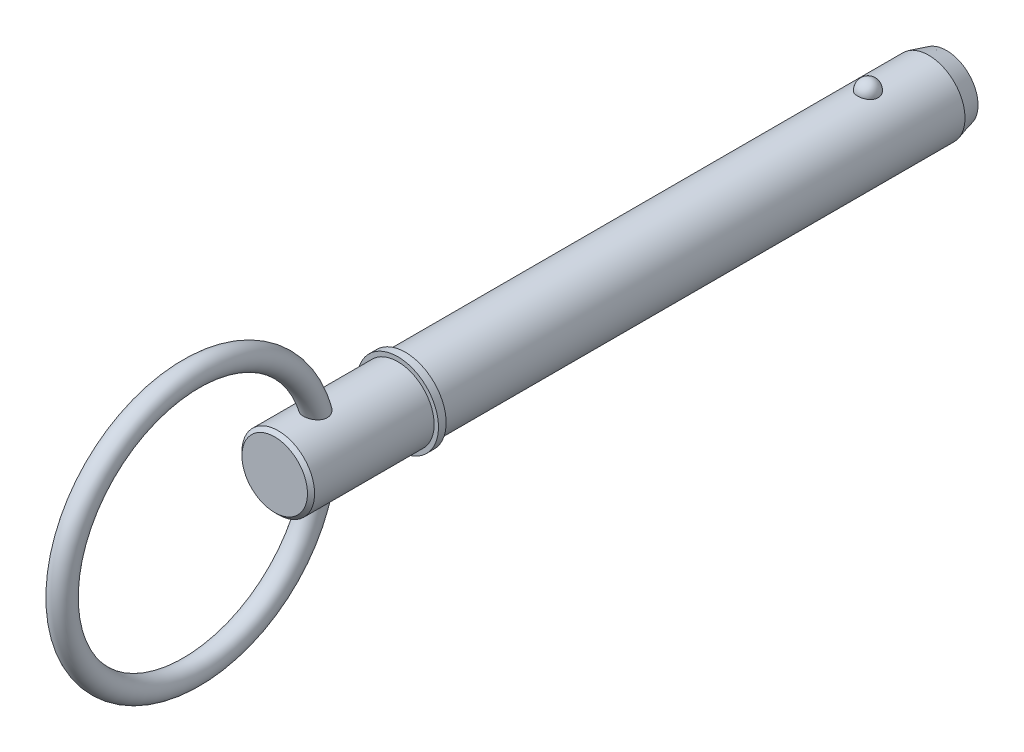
SolidWorks part; units mm, degrees
ref_plane "Front Plane" through (0, 0, 0) normal (0, 0, 1) x (1, 0, 0)
ref_plane "Top Plane" through (0, 0, 0) normal (0, 1, 0) x (1, 0, 0)
ref_plane "Right Plane" through (0, 0, 0) normal (1, 0, 0) x (0, 0, -1)
sketch "Sketch2" plane through (0, 0, 0) normal (0, 0, 1) x (1, 0, 0)
  circle A0 centre (0, 0) radius 7.145
  point P3 (0, 7.145)
  dimension "D1" = 14.29
extrude "Boss-Extrude1" add sketch "Sketch2" along normal blind 88.9
sketch "Sketch3" plane through (0, 0, 0) normal (0, 0, -1) x (-1, 0, 0)
  circle A0 centre (0, 0) radius 7.145
  dimension "D1" = 14.29
extrude "Boss-Extrude2" add sketch "Sketch3" along normal blind 17.45
chamfer "Chamfer1" distance 3.5 angle 15 1 edges at (-7.145, 0, -17.45)
sketch "Sketch18" plane through (0, 0, 0) normal (1, 0, 0) x (0, 0, -1)
  line L0 (13.95, 7.145) -> (-88.9, 7.145) construction
  line L1 (2.02, 9.165) -> (2.02, 5.125)
  line L2 (-88.9, -7.145) -> (13.95, -7.145) construction
  arc A0 (2.02, 9.165) -> (2.02, 5.125) centre (2.02, 7.145) ccw
  point P4 (0, 7.145)
  dimension "D1" = 16.31
revolve "Revolve1" add sketch "Sketch18" angle 360 about L1
sketch "Sketch19" plane through (0, 0, 0) normal (1, 0, 0) x (0, 0, -1)
  line L0 (-33.7288, 0) -> (-46.4542, 0) construction
sketch "Sketch20" plane through (0, 0, 0) normal (1, 0, 0) x (0, 0, -1)
  line L0 (-88.9, 0) -> (-88.9, 8)
  line L1 (-88.9, 7.145) -> (-88.9, -7.145) construction
  line L2 (-88.9, 8) -> (-90.4, 8)
  line L3 (-90.4, 8) -> (-90.4, 0)
  line L4 (-33.7288, 0) -> (-46.4542, 0) construction
  line L5 (-90.4, 0) -> (-88.9, 0)
  dimension "D1" = 8
  dimension "D2" = 1.5
revolve "Revolve2" add sketch "Sketch20" angle 360 about L0
sketch "Sketch21" plane through (0, 0, 88.9) normal (0, 0, -1) x (-1, 0, 0)
  circle A0 centre (0, 0) radius 7.145
  dimension "D1" = 14.29
extrude "Boss-Extrude3" add sketch "Sketch21" against normal blind 25.7
chamfer "Chamfer2" distance 0.7 angle 45 1 edges at (-7.145, 0, 114.6)
sketch "Sketch23" plane through (0, 0, 0) normal (1, 0, 0) x (0, 0, -1)
  line L0 (-114.6, 6.445) -> (-114.6, -6.445) construction
  circle A0 centre (-131, 0) radius 25.4
  point P2 (-105.6, 0)
  dimension "D1" = 50.8
  dimension "D2" = 9
sketch "Sketch24" plane through (0, 0, 0) normal (0, 1, 0) x (1, 0, 0)
  circle A0 centre (0, -105.6) radius 2.25
  dimension "D1" = 4.5
sweep "Sweep1" add profiles "Sketch24" path "Sketch23"
